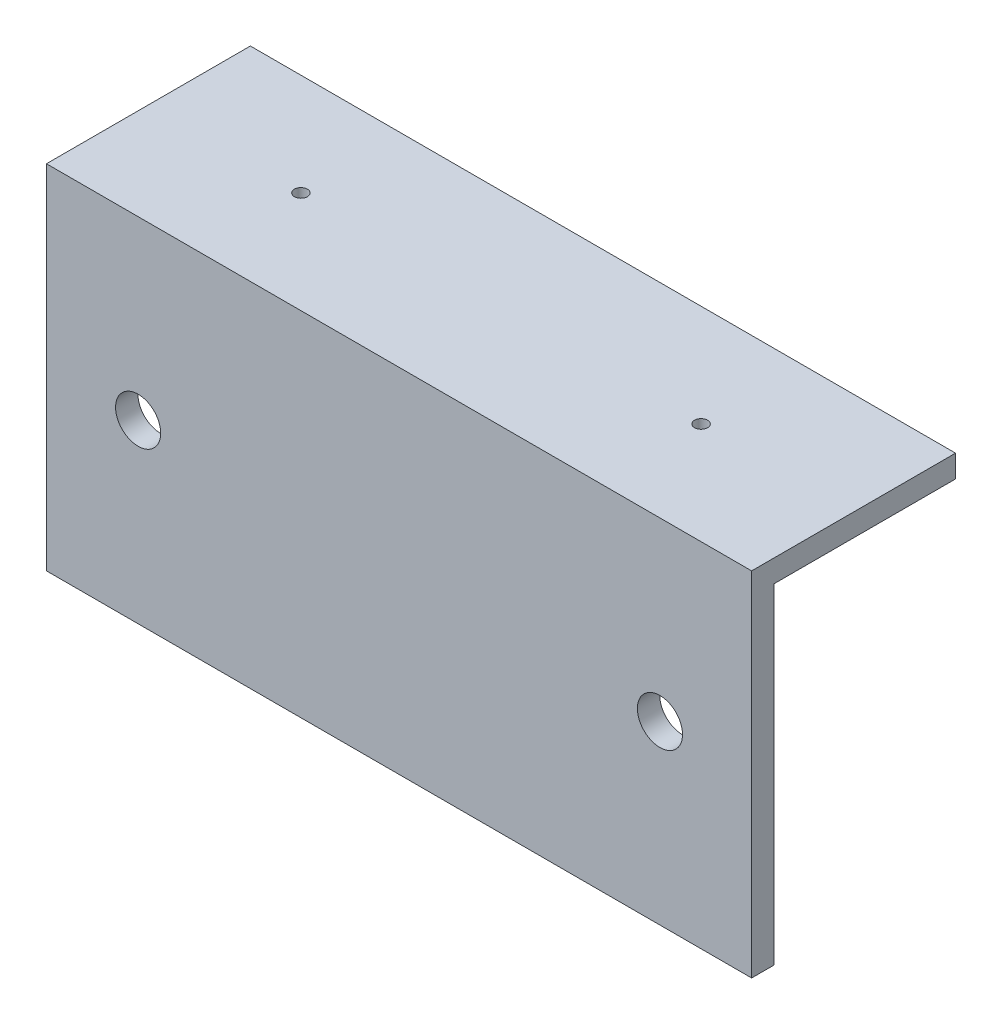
SolidWorks part; units mm, degrees
ref_plane "Front Plane" through (0, 0, 0) normal (0, 0, 1) x (1, 0, 0)
ref_plane "Top Plane" through (0, 0, 0) normal (0, 1, 0) x (1, 0, 0)
ref_plane "Right Plane" through (0, 0, 0) normal (1, 0, 0) x (0, 0, -1)
sketch "Sketch1" plane through (0, 0, 0) normal (0, 0, 1) x (1, 0, 0)
  line L0 (-25, 12.5) -> (-25, -12.5)
  line L1 (-25, -12.5) -> (25, -12.5)
  line L2 (25, -12.5) -> (25, 12.5)
  line L3 (25, 12.5) -> (-25, 12.5)
  line L4 (0, 12.5) -> (0, -12.5) construction
  line L5 (-25, 0) -> (25, 0) construction
  line L6 (-18.5, 0) -> (18.5, 0) construction
  circle A0 centre (-18.5, 0) radius 1.6
  circle A1 centre (18.5, 0) radius 1.6
  point P6 (0, 0)
  point P14 (0, 0)
  dimension "D3" = 3.2
  dimension "D4" = 37
  dimension "D1" = 50
  dimension "D2" = 25
extrude "Boss-Extrude1" add sketch "Sketch1" along normal blind 1.5875
sketch "Sketch2" plane through (0, 12.5, 0) normal (0, 1, 0) x (1, 0, 0)
  line L0 (-25, 0) -> (25, 0)
  line L1 (25, 0) -> (25, 12.871)
  line L2 (25, 12.871) -> (-25, 12.871)
  line L3 (-25, 12.871) -> (-25, 0)
  line L4 (-25, 6.4355) -> (25, 6.4355) construction
  point P10 (0, 6.4355)
  dimension "D1" = 12.871
extrude "Boss-Extrude2" add sketch "Sketch2" against normal blind 1.5875 contours L2 L3 L0 L1
sketch "Sketch3" plane through (0, 12.5, 0) normal (0, 1, 0) x (1, 0, 0)
  line L0 (-14.1859, 5.6417) -> (14.1859, 5.6417) construction
  line L2 (14.1859, 5.6417) -> (25, 5.6417) construction
  line L4 (25, -1.5875) -> (25, 12.871) construction
  circle A0 centre (-14.1859, 5.6417) radius 0.4636
  circle A1 centre (14.1859, 5.6417) radius 0.4636
  point P2 (0, 5.6417)
  dimension "D1" = 0.9271
  dimension "D2" = 28.3718
extrude "Cut-Extrude1" cut sketch "Sketch3" against normal blind 1.5875
